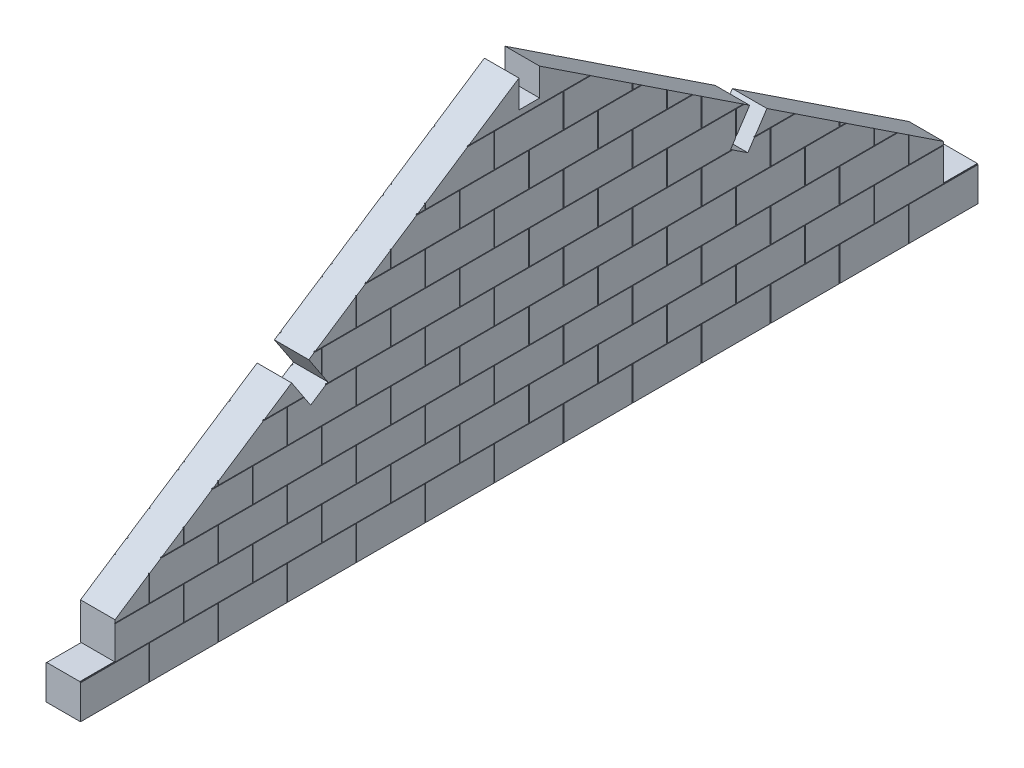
SolidWorks part; units mm, degrees
ref_plane "Face" through (0, 0, 0) normal (0, 0, 1) x (1, 0, 0)
ref_plane "Dessus" through (0, 0, 0) normal (0, 1, 0) x (1, 0, 0)
ref_plane "Droite" through (0, 0, 0) normal (1, 0, 0) x (0, 0, -1)
sketch "Esquisse1" plane through (0, 0, 0) normal (1, 0, 0) x (0, 0, -1)
  line L0 (0, 0) -> (650, 0)
  line L1 (650, 0) -> (650, 35)
  line L2 (0, 0) -> (0, 35)
  line L3 (0, 35) -> (325, 250)
  line L4 (650, 35) -> (325, 250)
  dimension "D1" = 650
  dimension "D2" = 325
  dimension "D3" = 250
  dimension "D4" = 35
  dimension "D5" = 35
  dimension "D6" = 33.486
extrude "Extrusion1" add sketch "Esquisse1" along normal blind 25
sketch "Esquisse3" plane through (25, 0, 0) normal (1, 0, 0) x (0, 0, -1)
  line L0 (317.5, 225) -> (332.5, 225)
  line L1 (332.5, 225) -> (332.5, 245.0385)
  line L2 (317.5, 225) -> (317.5, 245.0385)
  line L3 (650, 35) -> (325, 250) construction
  line L4 (325, 250) -> (0, 35) construction
  line L5 (332.5, 245.0385) -> (325, 250)
  line L6 (325, 250) -> (317.5, 245.0385)
  line L8 (625, 25) -> (625, 55)
  line L9 (0, 25) -> (25, 25)
  line L10 (0, 25) -> (0, 55)
  line L11 (0, 55) -> (25, 55)
  line L12 (325, 250) -> (325, 84.7463) construction
  line L13 (152.884, 136.1387) -> (166.6774, 115.2882)
  line L14 (179.1877, 123.5642) -> (166.6774, 115.2882)
  line L15 (165.3943, 144.4147) -> (179.1877, 123.5642)
  line L16 (165.3943, 144.4147) -> (152.884, 136.1387)
  line L17 (484.6057, 144.4147) -> (497.116, 136.1387)
  line L18 (484.6057, 144.4147) -> (470.8123, 123.5642)
  line L19 (470.8123, 123.5642) -> (483.3226, 115.2882)
  line L20 (497.116, 136.1387) -> (483.3226, 115.2882)
  line L21 (650, 55) -> (625, 55)
  line L22 (650, 25) -> (650, 55)
  line L23 (650, 25) -> (625, 25)
  line L24 (0, 0) -> (650, 0) construction
  line L25 (25, 25) -> (25, 55)
  dimension "D1" = 15
  dimension "D2" = 25
  dimension "D3" = 7.5
  dimension "D4" = 30
  dimension "D5" = 25
  dimension "D6" = 25
  dimension "D7" = 183.31
  dimension "D9" = 15
  dimension "D10" = 25
extrude "Enlèv. mat.-Extru.1" cut sketch "Esquisse3" against normal through all
sketch "Esquisse4" plane through (25, 0, 0) normal (1, 0, 0) x (0, 0, -1)
  line L0 (0, 0) -> (650, 0) construction
  line L1 (0, 24.5) -> (650, 24.5)
  line L2 (0, 24.5) -> (0, 25)
  line L3 (0, 25) -> (650, 25)
  line L4 (650, 24.5) -> (650, 25)
  dimension "D1" = 650
  dimension "D2" = 0.5
  dimension "D3" = 24.5
extrude "Enlèv. mat.-Extru.2" cut sketch "Esquisse4" against normal blind 0.5
pattern_linear "Répétition linéaire1" count 9 spacing 24.5 along (0, 1, 0) of "Enlèv. mat.-Extru.2"
ref_plane "Plan1" through (12.5, 0, 0) normal (1, 0, 0) x (0, 0, -1)
mirror "Symétrie1" about plane through (12.5, 0, 0) normal (1, 0, 0) of "Enlèv. mat.-Extru.2"
mirror "Symétrie2" about plane through (12.5, 0, 0) normal (1, 0, 0) of "Répétition linéaire1"
sketch "Esquisse5" plane through (25, 0, 0) normal (1, 0, 0) x (0, 0, -1)
  line L1 (50, 0) -> (49.5, 0)
  line L2 (50, 0) -> (50, 24.5)
  line L3 (50, 24.5) -> (49.5, 24.5)
  line L4 (49.5, 0) -> (49.5, 24.5)
  dimension "D1" = 24.5
  dimension "D2" = 0.5
  dimension "D3" = 49.5
extrude "Enlèv. mat.-Extru.3" cut sketch "Esquisse5" against normal blind 0.5
pattern_linear "Répétition linéaire3" count 12 spacing 50 along (0, 0, -1) of "Enlèv. mat.-Extru.3"
mirror "Symétrie3" about plane through (12.5, 0, 0) normal (1, 0, 0) of "Enlèv. mat.-Extru.3"
pattern_linear "Répétition linéaire4" count 5 spacing 49 along (0, 1, 0) of "Répétition linéaire3", "Enlèv. mat.-Extru.3"
mirror "Symétrie4" about plane through (12.5, 0, 0) normal (1, 0, 0) of "Répétition linéaire4", "Répétition linéaire3"
sketch "Esquisse7" plane through (25, 0, 0) normal (1, 0, 0) x (0, 0, -1)
  line L0 (625, 25) -> (25, 25) construction
  line L1 (74.5, 25) -> (75, 25)
  line L2 (74.5, 25) -> (74.5, 49)
  line L3 (74.5, 49) -> (75, 49)
  line L4 (75, 25) -> (75, 49)
  dimension "D1" = 24
  dimension "D2" = 0.5
  dimension "D3" = 74.5
extrude "Enlèv. mat.-Extru.4" cut sketch "Esquisse7" against normal blind 0.5
pattern_linear "Répétition linéaire5" count 11 spacing 50 along (0, 0, -1) of "Enlèv. mat.-Extru.4"
pattern_linear "Répétition linéaire6" count 4 spacing 49 along (0, 1, 0) of "Répétition linéaire5", "Enlèv. mat.-Extru.4"
mirror "Symétrie8" about plane through (12.5, 0, 0) normal (1, 0, 0) of "Enlèv. mat.-Extru.4"
pattern_linear "Répétition linéaire8" count 11 spacing 50 along (0, 0, -1) of "Symétrie8"
pattern_linear "Répétition linéaire9" count 4 spacing 49 along (0, 1, 0) of "Répétition linéaire8", "Symétrie8"
